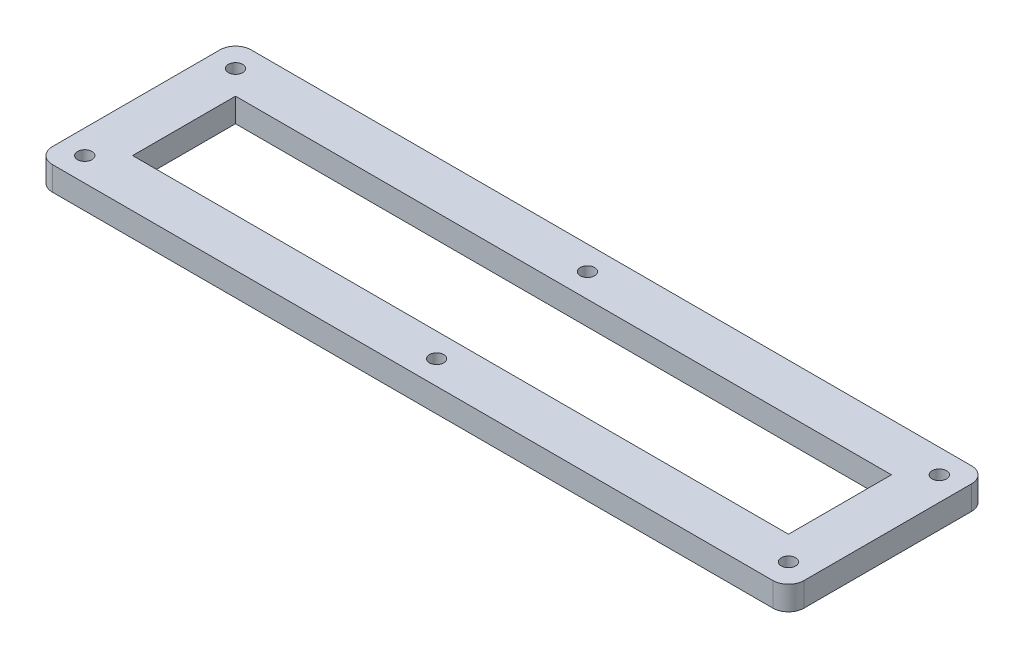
SolidWorks part; units mm, degrees
ref_plane "Front Plane" through (0, 0, 0) normal (0, 0, 1) x (1, 0, 0)
ref_plane "Top Plane" through (0, 0, 0) normal (0, 1, 0) x (1, 0, 0)
ref_plane "Right Plane" through (0, 0, 0) normal (1, 0, 0) x (0, 0, -1)
sketch "Sketch1" plane through (0, 0, 0) normal (0, 1, 0) x (1, 0, 0)
  line L1 (-39.878, 21.082) -> (39.878, 21.082)
  line L2 (-39.878, 21.082) -> (-39.878, -21.082)
  line L3 (-39.878, -21.082) -> (39.878, -21.082)
  line L4 (39.878, 21.082) -> (39.878, -21.082)
  line L5 (-39.878, 21.082) -> (39.878, -21.082) construction
  line L6 (-39.878, -21.082) -> (39.878, 21.082) construction
  point P0 (0, 0)
  dimension "D1" = 42.164
  dimension "D2" = 79.756
extrude "Plate" add sketch "Sketch1" along normal blind 5.08
fillet "Fillet1" radius 3.302 2 edges at (-39.878, 2.54, -21.082) (-39.878, 2.54, 21.082)
sketch "Sketch3" plane through (0, 5.08, 0) normal (0, 1, 0) x (1, 0, 0)
  line L0 (39.878, -21.082) -> (39.878, 21.082) construction
  line L1 (39.878, 10.922) -> (-29.718, 10.922)
  line L2 (39.878, 10.922) -> (39.878, -10.922)
  line L3 (39.878, -10.922) -> (-29.718, -10.922)
  line L4 (-29.718, 10.922) -> (-29.718, -10.922)
  line L5 (-39.878, 17.78) -> (-39.878, -17.78) construction
  line L6 (39.878, 21.082) -> (-36.576, 21.082) construction
  line L7 (-36.576, -21.082) -> (39.878, -21.082) construction
  dimension "D1" = 10.16
  dimension "D2" = 10.16
  dimension "D3" = 10.16
extrude "CenterHole" cut sketch "Sketch3" against normal through all
sketch "Sketch2" plane through (0, 5.08, 0) normal (0, 1, 0) x (1, 0, 0)
  line L1 (39.878, -21.082) -> (39.878, -10.922) construction
  line L2 (39.878, 21.082) -> (-36.576, 21.082) construction
  line L3 (-36.576, -21.082) -> (39.878, -21.082) construction
  line L4 (-39.878, 17.78) -> (-39.878, -17.78) construction
  circle A0 centre (-34.798, 16.002) radius 1.524
  circle A1 centre (39.878, 16.002) radius 1.524
  circle A2 centre (-34.798, -16.002) radius 1.524
  circle A3 centre (39.878, -16.002) radius 1.524
  dimension "D6" = 3.048
  dimension "D1" = 74.676
  dimension "D2" = 5.08
  dimension "D3" = 5.08
  dimension "D4" = 32.004
  dimension "D5" = 5.08
extrude "4-40ThruHoles" cut sketch "Sketch2" against normal through all
mirror "Mirror1" about plane through (39.878, 5.08, -21.082) normal (-1, 0, 0) of "4-40ThruHoles", "CenterHole", "Fillet1", "Plate"
